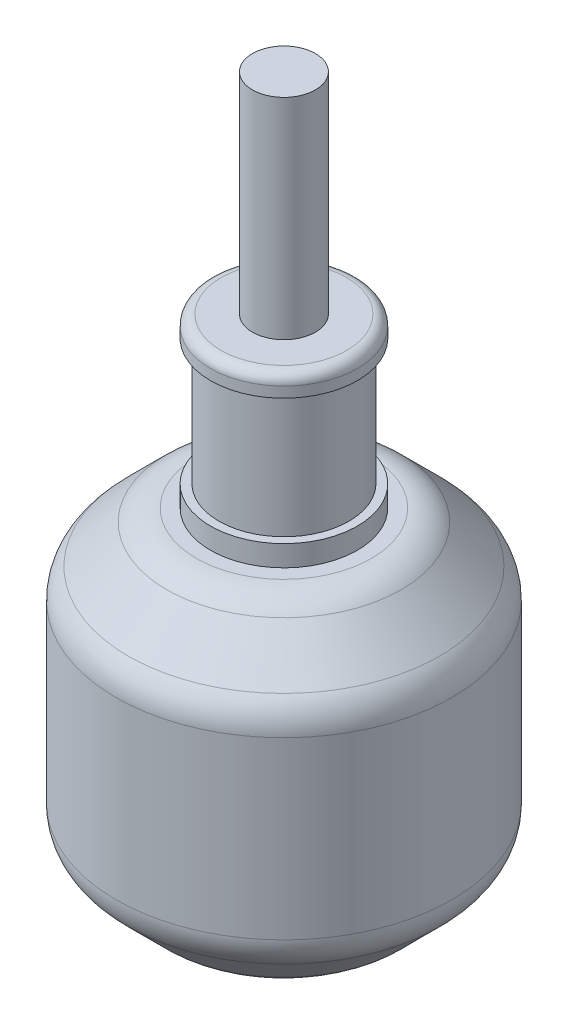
SolidWorks part; units mm, degrees
ref_plane "前视基准面" through (0, 0, 0) normal (0, 0, 1) x (1, 0, 0)
ref_plane "上视基准面" through (0, 0, 0) normal (0, 1, 0) x (1, 0, 0)
ref_plane "右视基准面" through (0, 0, 0) normal (1, 0, 0) x (0, 0, -1)
other "Configuration Table"
sketch "草图1" plane through (0, 0, 0) normal (0, 1, 0) x (1, 0, 0)
  circle A0 centre (0, 0) radius 3.1
extrude "凸台-拉伸1" add sketch "草图1" along normal blind 6
sketch "草图2" plane through (0, 6, 0) normal (0, 1, 0) x (1, 0, 0)
  circle A0 centre (0, 0) radius 3.5
extrude "凸台-拉伸2" add sketch "草图2" along normal blind 1
sketch "草图3" plane through (0, 0, 0) normal (0, -1, 0) x (1, 0, 0)
  circle A0 centre (0, 0) radius 3.5
extrude "凸台-拉伸3" add sketch "草图3" along normal blind 1
sketch "草图4" plane through (0, 0, 0) normal (0, 0, 1) x (1, 0, 0)
  line L0 (0, -1) -> (0, -17)
  line L1 (-3.5, -1) -> (3.5, -1) construction
  line L2 (0, -1) -> (4.1716, -1)
  line L5 (5.5858, -1.5858) -> (7.4142, -3.4142)
  line L6 (8, -4.8284) -> (8, -13.1716)
  line L10 (5.5858, -16.4142) -> (7.4142, -14.5858)
  line L11 (4.1716, -17) -> (0, -17)
  arc A0 (5.5858, -1.5858) -> (4.1716, -1) centre (4.1716, -3) ccw
  arc A1 (8, -4.8284) -> (7.4142, -3.4142) centre (6, -4.8284) ccw
  arc A2 (7.4142, -14.5858) -> (8, -13.1716) centre (6, -13.1716) ccw
  arc A3 (4.1716, -17) -> (5.5858, -16.4142) centre (4.1716, -15) ccw
  dimension "D1" = 2
  dimension "D2" = 2
  dimension "D3" = 2
  dimension "D4" = 2
revolve "旋转1" add sketch "草图4" angle 360 about L0
fillet "圆角3" radius 0.5 1 edges at (0, 7, 3.5)
sketch "草图5" plane through (0, 7, 0) normal (0, 1, 0) x (1, 0, 0)
  circle A0 centre (0, 0) radius 1.5
extrude "凸台-拉伸4" add sketch "草图5" along normal blind 10
